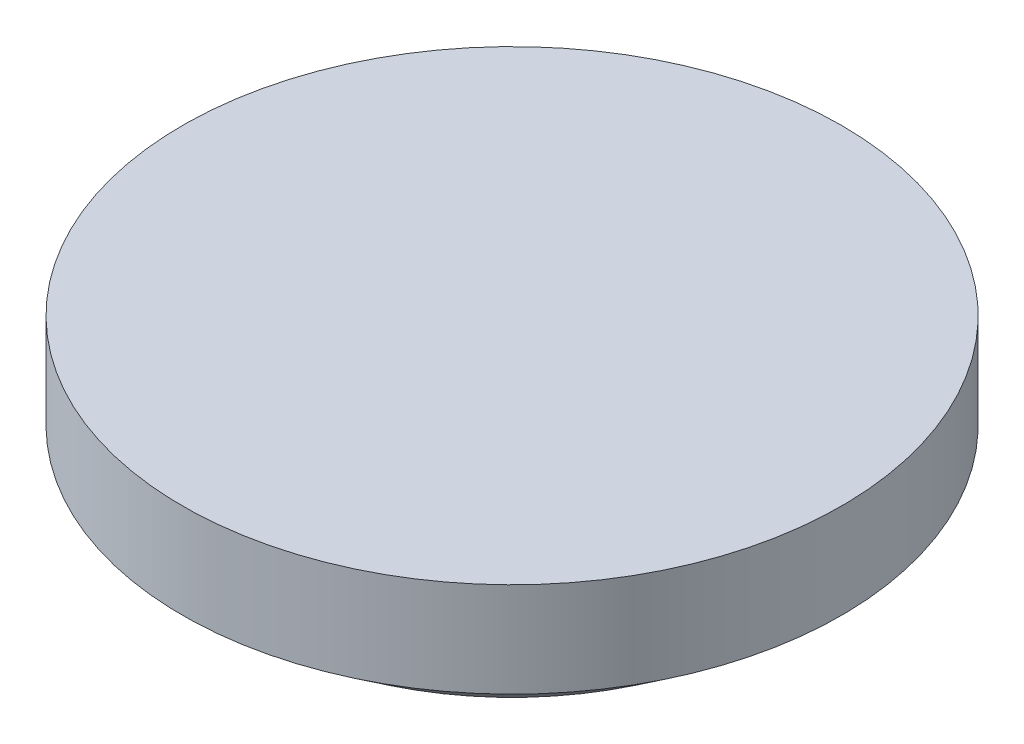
SolidWorks part; units mm, degrees
ref_plane "前视基准面" through (0, 0, 0) normal (0, 0, 1) x (1, 0, 0)
ref_plane "上视基准面" through (0, 0, 0) normal (0, 1, 0) x (1, 0, 0)
ref_plane "右视基准面" through (0, 0, 0) normal (1, 0, 0) x (0, 0, -1)
sketch "草图1" plane through (0, 0, 0) normal (0, 0, 1) x (1, 0, 0)
  line L0 (0, 0) -> (0, 587.7508) construction
  line L1 (0, 350) -> (-800, 350)
  line L2 (-800, 350) -> (-800, 120)
  line L3 (-800, 120) -> (-640, 0)
  line L4 (-640, 0) -> (0, 0)
  line L5 (0, 0) -> (0, 350)
  dimension "D1" = 1600
  dimension "D2" = 1280
  dimension "D3" = 230
  dimension "D4" = 120
revolve "旋转1" add sketch "草图1" angle 360 about L0
